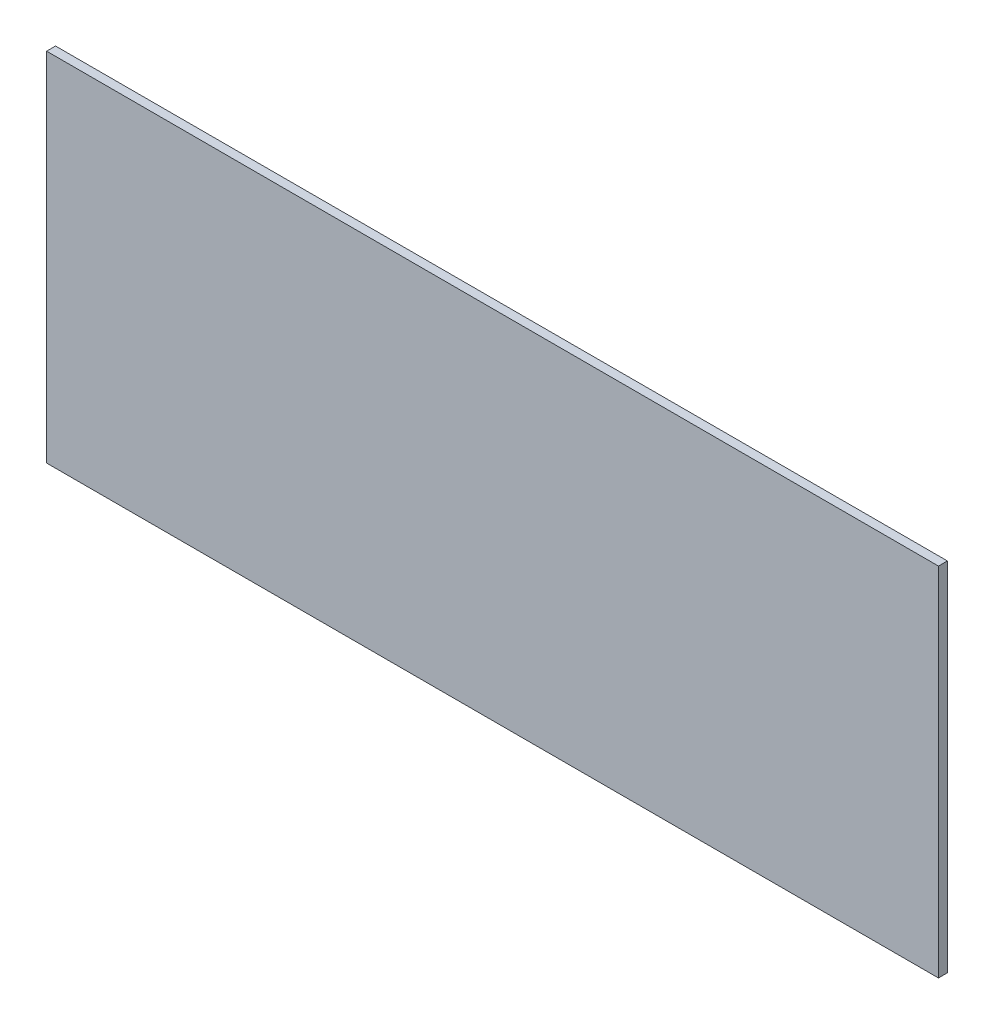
SolidWorks part; units mm, degrees
ref_plane "Front Plane" through (0, 0, 0) normal (0, 0, 1) x (1, 0, 0)
ref_plane "Top Plane" through (0, 0, 0) normal (0, 1, 0) x (1, 0, 0)
ref_plane "Right Plane" through (0, 0, 0) normal (1, 0, 0) x (0, 0, -1)
sketch "Sketch1" plane through (0, 0, 0) normal (0, 0, 1) x (1, 0, 0)
  line L0 (1, 1) -> (9, 1) construction
  line L1 (0, 0) -> (10, 0)
  line L2 (0, 0) -> (0, 4)
  line L3 (0, 4) -> (10, 4)
  line L4 (10, 0) -> (10, 4)
  dimension "D1" = 4
  dimension "D2" = 10
  dimension "D3" = 1
  dimension "D4" = 1
  dimension "D5" = 1
extrude "Boss-Extrude1" add sketch "Sketch1" along normal blind 0.1 contours L2 L3 L4 L1
sketch "Sketch2" plane through (0, 0, 0.1) normal (0, 0, 1) x (1, 0, 0)
  text T0 "00501" font "Century Gothic" height 2
